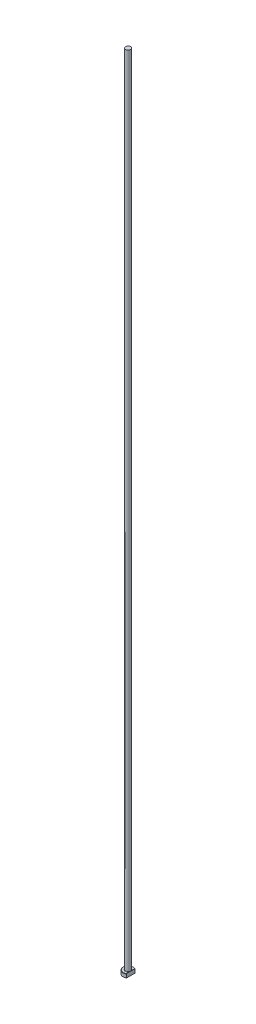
SolidWorks part; units mm, degrees
ref_plane "Front Plane" through (0, 0, 0) normal (0, 0, 1) x (1, 0, 0)
ref_plane "Top Plane" through (0, 0, 0) normal (0, 1, 0) x (1, 0, 0)
ref_plane "Right Plane" through (0, 0, 0) normal (1, 0, 0) x (0, 0, -1)
sketch "Sketch1" plane through (0, 0, 0) normal (0, 0, 1) x (1, 0, 0)
  line L0 (0, 259.9588) -> (0, -15.1925) construction
  line L1 (0, 0) -> (-4, 0)
  line L2 (-4, 0) -> (-4, 3)
  line L3 (-4, 3) -> (-2, 3)
  line L4 (-2, 3) -> (-2, 630)
  line L5 (-2, 630) -> (0, 630)
  line L6 (0, 630) -> (0, 0)
  dimension "L" = 630
  dimension "H" = 8
  dimension "T" = 3
  dimension "D" = 4
revolve "Revolve1" add sketch "Sketch1" angle 360 about L0
chamfer "Chamfer1" distance 0.2 angle 45 2 edges at (0, 3, 4) (0, 0, 4)
fillet "Fillet1" radius 0.2 1 edges at (0, 3, 2)
sketch "Sketch2" plane through (0, 0, 0) normal (0, 1, 0) x (1, 0, 0)
  line L0 (2, 3.4641) -> (2, -3.4641)
  circle A0 centre (0, 0) radius 4 construction
  arc A1 (2, -3.4641) -> (2, 3.4641) centre (0, 0) ccw
  circle A2 centre (0, 0) radius 2 construction
extrude "KEY" cut sketch "Sketch2" along normal through all
